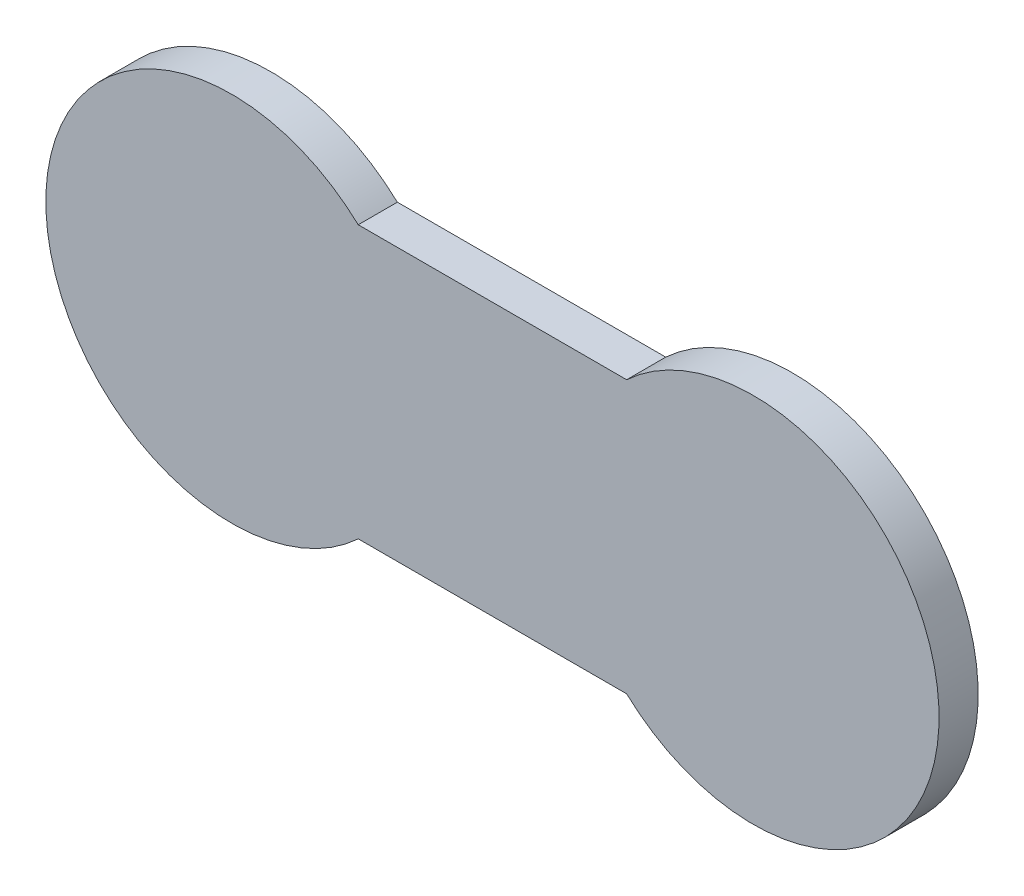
SolidWorks part; units mm, degrees
ref_plane "Plan de face" through (0, 0, 0) normal (0, 0, 1) x (1, 0, 0)
ref_plane "Plan de dessus" through (0, 0, 0) normal (0, 1, 0) x (1, 0, 0)
ref_plane "Plan de droite" through (0, 0, 0) normal (1, 0, 0) x (0, 0, -1)
sketch "Esquisse2" plane through (0, 0, 0) normal (0, 0, 1) x (1, 0, 0)
  line L0 (49.4186, 9) -> (90.5814, 9)
  line L1 (49.4186, 50.7214) -> (90.5814, 50.7214)
  line L2 (50, 7.5) -> (90, 7.5) construction
  line L3 (50, 52.2214) -> (90, 52.2214) construction
  arc A0 (50, 52.2214) -> (50, 7.5) centre (30, 29.8607) ccw construction
  arc A1 (90, 52.2214) -> (90, 7.5) centre (110, 29.8607) cw construction
  arc A2 (49.4186, 50.7214) -> (49.4186, 9) centre (30, 29.8607) ccw
  arc A3 (90.5814, 50.7214) -> (90.5814, 9) centre (110, 29.8607) cw
  dimension "D1" = 1.5
extrude "Boss.-Extru.2" add sketch "Esquisse2" along normal blind 6
